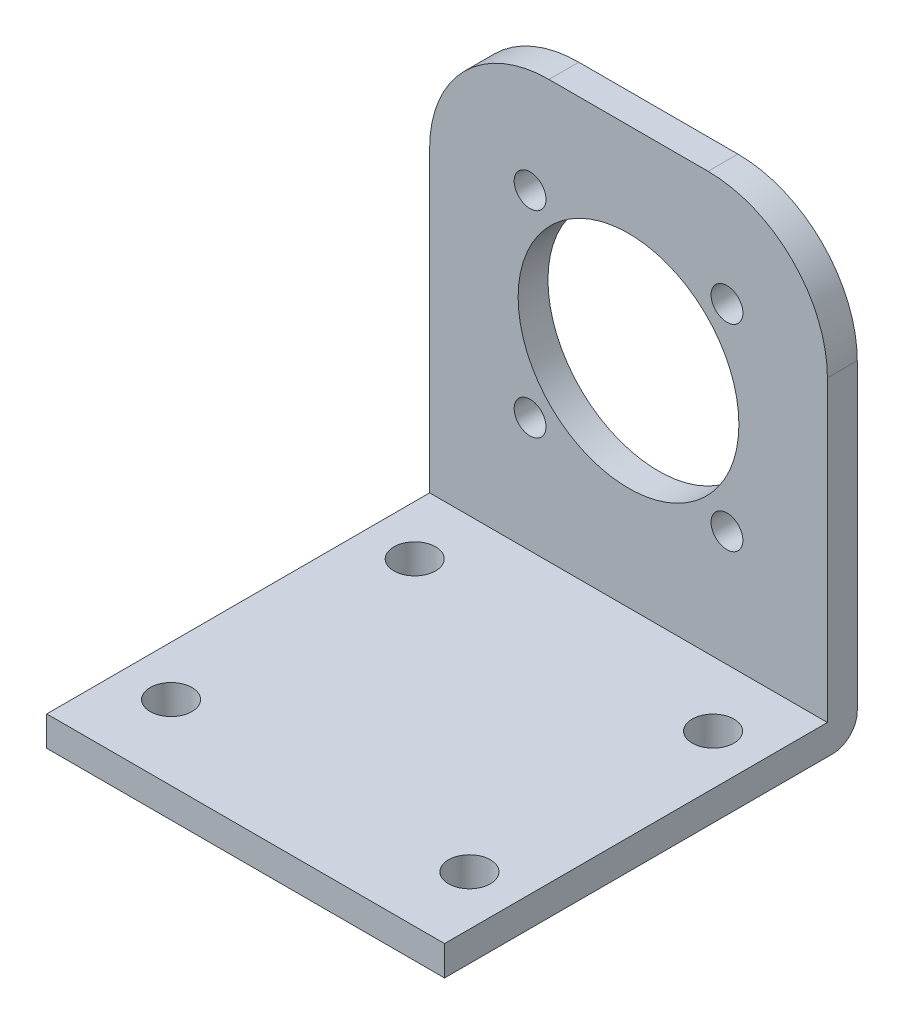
SolidWorks part; units mm, degrees
ref_plane "Front Plane" through (0, 0, 0) normal (0, 0, 1) x (1, 0, 0)
ref_plane "Top Plane" through (0, 0, 0) normal (0, 1, 0) x (1, 0, 0)
ref_plane "Right Plane" through (0, 0, 0) normal (1, 0, 0) x (0, 0, -1)
sketch "Sketch1" plane through (0, 0, 0) normal (1, 0, 0) x (0, 0, -1)
  line L0 (23.1464, 33.4195) -> (23.1464, -8.5805)
  line L1 (23.1464, -8.5805) -> (-15.3536, -8.5805)
  line L2 (-15.3536, -8.5805) -> (-15.3536, -11.5805)
  line L3 (-15.3536, -11.5805) -> (23.6464, -11.5805)
  line L4 (26.1464, -9.0805) -> (26.1464, 33.4195)
  line L5 (26.1464, 33.4195) -> (23.1464, 33.4195)
  arc A0 (23.6464, -11.5805) -> (26.1464, -9.0805) centre (23.6464, -9.0805) ccw
  point P8 (26.1464, -11.5805)
  dimension "D5" = 2.5
  dimension "D1" = 41.5
  dimension "D2" = 45
  dimension "D3" = 3
  dimension "D4" = 3
extrude "Boss-Extrude1" add sketch "Sketch1" against normal blind 40
sketch "Sketch2" plane through (0, 0, -23.1464) normal (0, 0, 1) x (1, 0, 0)
  line L0 (-40, 33.4195) -> (0, 33.4195) construction
  line L1 (-31.1, 12.9195) -> (-8.9, 12.9195)
  circle A1 centre (-20, 12.9195) radius 11.1
  circle A2 centre (-10.1005, 22.819) radius 1.6
  circle A4 centre (-29.8995, 3.02) radius 1.6
  circle A5 centre (-29.8995, 22.819) radius 1.6
  circle A6 centre (-10.1005, 3.02) radius 1.6
  point P0 (-20, 12.9195)
  dimension "D3" = 22.2
  dimension "D4" = 3.2
  dimension "D5" = 3.2
  dimension "D6" = 3.2
  dimension "D7" = 3.2
  dimension "D1" = 20.5
extrude "Cut-Extrude1" cut sketch "Sketch2" against normal blind 40 contours A1 | A4 | A6 | A2 | A5
sketch "Sketch3" plane through (0, 0, -23.1464) normal (0, 0, 1) x (1, 0, 0)
  line L1 (0, 21.4195) -> (0, 33.4195)
  line L3 (0, 33.4195) -> (-12, 33.4195)
  line L5 (-28, 33.4195) -> (-40, 33.4195)
  line L6 (-40, 33.4195) -> (-40, 21.4195)
  arc A0 (-12, 33.4195) -> (0, 21.4195) centre (-12, 21.4195) cw
  arc A1 (-28, 33.4195) -> (-40, 21.4195) centre (-28, 21.4195) ccw
  dimension "D1" = 12
extrude "Cut-Extrude2" cut sketch "Sketch3" against normal blind 40
sketch "Sketch4" plane through (0, -8.5805, 0) normal (0, 1, 0) x (1, 0, 0)
  line L0 (-40, -15.3536) -> (0, -15.3536) construction
  line L1 (-5, -7.8536) -> (-35, -7.8536)
  line L2 (-5, -7.8536) -> (-5, 16.6464)
  line L3 (-5, 16.6464) -> (-35, 16.6464)
  line L4 (-35, -7.8536) -> (-35, 16.6464)
  line L5 (-5, -7.8536) -> (-35, 16.6464) construction
  line L6 (-5, 16.6464) -> (-35, -7.8536) construction
  line L8 (0, 23.1464) -> (0, -15.3536) construction
  circle A0 centre (-5, -7.8536) radius 2.1
  circle A1 centre (-35, -7.8536) radius 2.1
  circle A2 centre (-35, 16.6464) radius 2.1
  circle A3 centre (-5, 16.6464) radius 2.1
  point P0 (-20, 4.3964)
  dimension "D4" = 4.2
  dimension "D5" = 4.2
  dimension "D6" = 4.2
  dimension "D7" = 4.2
  dimension "D1" = 30
  dimension "D2" = 24.5
  dimension "D3" = 7.5
  dimension "D8" = 5
extrude "Cut-Extrude3" cut sketch "Sketch4" against normal blind 40 contours A1 | A2 | A0 | A3
